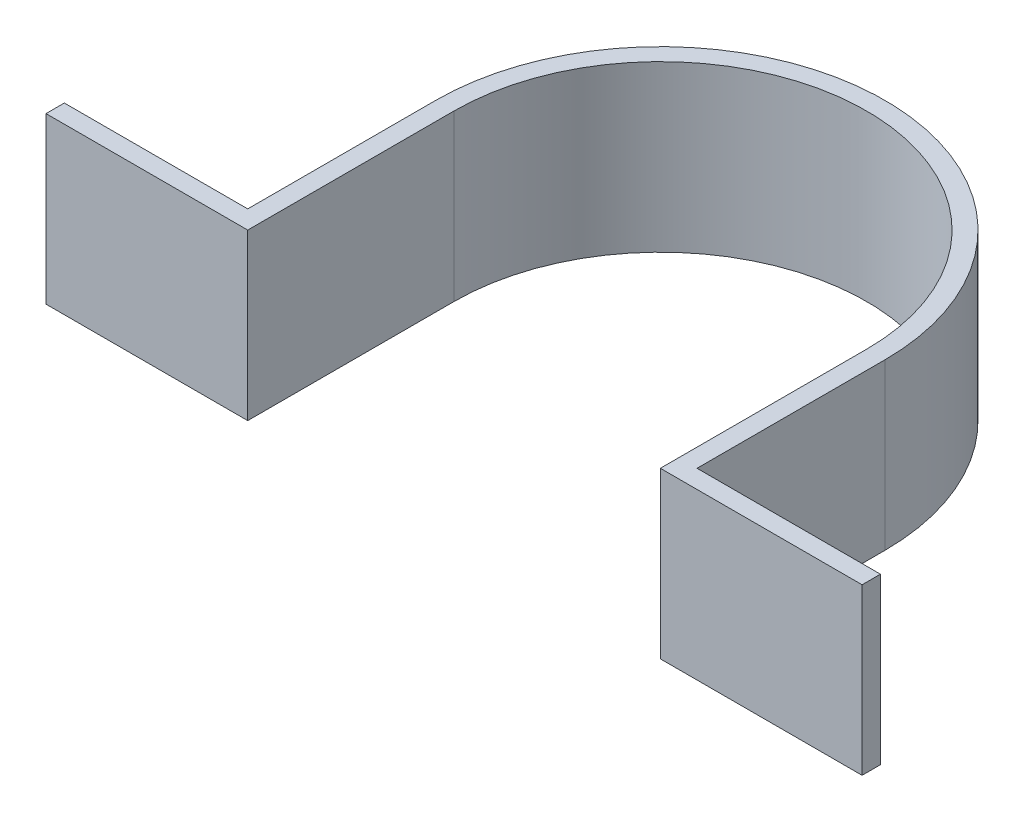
SolidWorks part; units mm, degrees
ref_plane "Front Plane" through (0, 0, 0) normal (0, 0, 1) x (1, 0, 0)
ref_plane "Top Plane" through (0, 0, 0) normal (0, 1, 0) x (1, 0, 0)
ref_plane "Right Plane" through (0, 0, 0) normal (1, 0, 0) x (0, 0, -1)
sketch "Sketch1" plane through (0, 0, 0) normal (0, 1, 0) x (1, 0, 0)
  line L29 (22.5, 0) -> (22.5, -22.5)
  line L30 (-22.5, 0) -> (-22.5, -22.5)
  line L31 (24.5, -20.5) -> (44.5, -20.5)
  line L32 (-24.5, -20.5) -> (-44.5, -20.5)
  line L33 (24.5, 0) -> (24.5, -20.5)
  line L34 (-24.5, 0) -> (-24.5, -20.5)
  line L35 (22.5, -22.5) -> (44.5, -22.5)
  line L36 (-22.5, -22.5) -> (-44.5, -22.5)
  line L37 (44.5, -22.5) -> (44.5, -20.5)
  line L38 (-44.5, -22.5) -> (-44.5, -20.5)
  arc A7 (22.5, 0) -> (-22.5, 0) centre (0, 0) ccw
  arc A8 (24.5, 0) -> (-24.5, 0) centre (0, 0) ccw
extrude "Boss-Extrude1" add sketch "Sketch1" along normal blind 18
